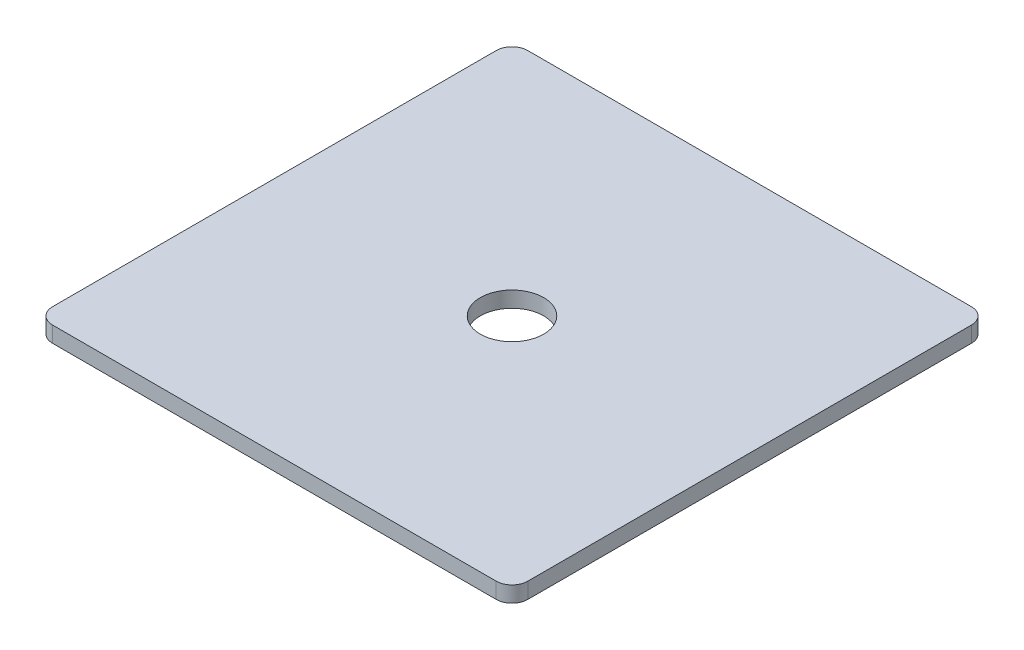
SolidWorks part; units mm, degrees
ref_plane "Ebene vorne" through (0, 0, 0) normal (0, 0, 1) x (1, 0, 0)
ref_plane "Ebene oben" through (0, 0, 0) normal (0, 1, 0) x (1, 0, 0)
ref_plane "Ebene rechts" through (0, 0, 0) normal (1, 0, 0) x (0, 0, -1)
sketch "Skizze1" plane through (0, 0, 0) normal (0, 1, 0) x (1, 0, 0)
  line L0 (0, 48.4677) -> (0, -69.9367) construction
  line L1 (-56, 60) -> (56, 60)
  line L2 (-60, 56) -> (-60, -56)
  line L3 (-56, -60) -> (56, -60)
  line L4 (60, 56) -> (60, -56)
  line L5 (-63.2683, 0) -> (64.2442, 0) construction
  circle A0 centre (0, 0) radius 8
  arc A1 (-60, -56) -> (-56, -60) centre (-56, -56) ccw
  arc A2 (56, -60) -> (60, -56) centre (56, -56) ccw
  arc A3 (60, 56) -> (56, 60) centre (56, 56) ccw
  arc A4 (-56, 60) -> (-60, 56) centre (-56, 56) ccw
  point P13 (-60, -60)
  point P18 (60, 60)
  point P21 (-60, 60)
  dimension "D3" = 16
  dimension "D4" = 4
  dimension "D1" = 120
  dimension "D2" = 120
extrude "Aufsatz-Linear austragen1" add sketch "Skizze1" along normal blind 4
